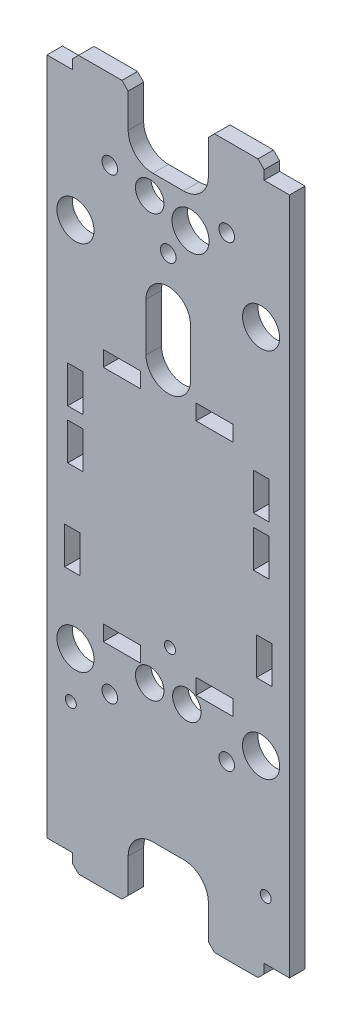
SolidWorks part; units mm, degrees
ref_plane "Front Plane" through (0, 0, 0) normal (0, 0, 1) x (1, 0, 0)
ref_plane "Top Plane" through (0, 0, 0) normal (0, 1, 0) x (1, 0, 0)
ref_plane "Right Plane" through (0, 0, 0) normal (1, 0, 0) x (0, 0, -1)
sketch "Sketch1" plane through (0, 0, 0) normal (0, 0, 1) x (1, 0, 0)
  line L1 (-24.892, 72.771) -> (24.892, 72.771)
  line L2 (-24.892, 72.771) -> (-24.892, -72.771)
  line L3 (-24.892, -72.771) -> (24.892, -72.771)
  line L4 (24.892, 72.771) -> (24.892, -72.771)
  line L5 (-24.892, 72.771) -> (24.892, -72.771) construction
  line L6 (-24.892, -72.771) -> (24.892, 72.771) construction
  point P0 (0, 0)
  dimension "D1" = 49.784
  dimension "D2" = 145.542
extrude "Boss-Extrude1" add sketch "Sketch1" along normal blind 3.175
sketch "Sketch2" plane through (0, 0, 0) normal (0, 0, -1) x (-1, 0, 0)
  line L0 (-24.892, 72.771) -> (24.892, 72.771) construction
  line L1 (-8.2296, 75.946) -> (8.2296, 75.946)
  line L2 (-8.2296, 75.946) -> (-8.2296, 69.596)
  line L3 (-8.2296, 69.596) -> (8.2296, 69.596)
  line L4 (8.2296, 75.946) -> (8.2296, 69.596)
  line L5 (-8.2296, 75.946) -> (8.2296, 69.596) construction
  line L6 (-8.2296, 69.596) -> (8.2296, 75.946) construction
  line L7 (0, 72.771) -> (0, -72.771) construction
  line L8 (-30.099, 75.946) -> (-19.685, 75.946)
  line L9 (-30.099, 75.946) -> (-30.099, 69.596)
  line L10 (-30.099, 69.596) -> (-19.685, 69.596)
  line L11 (-19.685, 75.946) -> (-19.685, 69.596)
  line L12 (-30.099, 75.946) -> (-19.685, 69.596) construction
  line L13 (-30.099, 69.596) -> (-19.685, 75.946) construction
  line L14 (24.892, -72.771) -> (-24.892, -72.771) construction
  line L15 (-24.892, 0) -> (24.892, 0) construction
  line L16 (-24.892, -72.771) -> (-24.892, 72.771) construction
  line L17 (24.892, 72.771) -> (24.892, -72.771) construction
  line L18 (30.099, 69.596) -> (19.685, 75.946) construction
  line L19 (30.099, 75.946) -> (19.685, 69.596) construction
  line L20 (19.685, 75.946) -> (19.685, 69.596)
  line L21 (30.099, 69.596) -> (19.685, 69.596)
  line L22 (30.099, 75.946) -> (30.099, 69.596)
  line L23 (30.099, 75.946) -> (19.685, 75.946)
  line L24 (30.099, -75.946) -> (19.685, -69.596) construction
  line L25 (30.099, -69.596) -> (19.685, -75.946) construction
  line L26 (-30.099, -69.596) -> (-19.685, -75.946) construction
  line L27 (-30.099, -75.946) -> (-19.685, -69.596) construction
  line L28 (-8.2296, -69.596) -> (8.2296, -75.946) construction
  line L29 (-8.2296, -75.946) -> (8.2296, -69.596) construction
  line L30 (30.099, -75.946) -> (19.685, -75.946)
  line L31 (30.099, -75.946) -> (30.099, -69.596)
  line L32 (30.099, -69.596) -> (19.685, -69.596)
  line L33 (19.685, -75.946) -> (19.685, -69.596)
  line L34 (-19.685, -75.946) -> (-19.685, -69.596)
  line L35 (-30.099, -69.596) -> (-19.685, -69.596)
  line L36 (-30.099, -75.946) -> (-30.099, -69.596)
  line L37 (-30.099, -75.946) -> (-19.685, -75.946)
  line L38 (8.2296, -75.946) -> (8.2296, -69.596)
  line L39 (-8.2296, -69.596) -> (8.2296, -69.596)
  line L40 (-8.2296, -75.946) -> (-8.2296, -69.596)
  line L41 (-8.2296, -75.946) -> (8.2296, -75.946)
  point P0 (0, 72.771)
  point P7 (-24.892, 72.771)
  point P27 (24.892, 72.771)
  point P40 (24.892, -72.771)
  point P41 (-24.892, -72.771)
  point P42 (0, -72.771)
extrude "Cut-Extrude1" cut sketch "Sketch2" against normal through all
sketch "Sketch3" plane through (0, 0, 0) normal (0, 0, -1) x (-1, 0, 0)
  line L0 (0, 69.596) -> (0, -69.596) construction
  line L1 (-8.2296, 69.596) -> (8.2296, 69.596) construction
  line L2 (8.2296, -69.596) -> (-8.2296, -69.596) construction
  line L3 (-24.892, 0) -> (24.892, 0) construction
  line L4 (-24.892, -69.596) -> (-24.892, 69.596) construction
  line L5 (24.892, 69.596) -> (24.892, -69.596) construction
  line L6 (-8.2296, -59.436) -> (8.2296, -79.756) construction
  line L7 (-8.2296, 79.756) -> (8.2296, 79.756)
  line L8 (-8.2296, 79.756) -> (-8.2296, 64.516)
  line L9 (-3.1496, 59.436) -> (3.1496, 59.436)
  line L10 (8.2296, 79.756) -> (8.2296, 64.516)
  line L11 (-8.2296, 79.756) -> (8.2296, 59.436) construction
  line L12 (-8.2296, 59.436) -> (8.2296, 79.756) construction
  line L13 (-8.2296, -79.756) -> (8.2296, -59.436) construction
  line L14 (8.2296, -79.756) -> (8.2296, -64.516)
  line L15 (-3.1496, -59.436) -> (3.1496, -59.436)
  line L16 (-8.2296, -79.756) -> (-8.2296, -64.516)
  line L17 (-8.2296, -79.756) -> (8.2296, -79.756)
  arc A0 (-8.2296, 64.516) -> (-3.1496, 59.436) centre (-3.1496, 64.516) ccw
  arc A1 (3.1496, 59.436) -> (8.2296, 64.516) centre (3.1496, 64.516) ccw
  arc A2 (3.1496, -59.436) -> (8.2296, -64.516) centre (3.1496, -64.516) cw
  arc A3 (-8.2296, -64.516) -> (-3.1496, -59.436) centre (-3.1496, -64.516) cw
  dimension "D3" = 5.08
  dimension "D4" = 5.08
  dimension "D1" = 20.32
  dimension "D2" = 16.4592
extrude "Cut-Extrude2" cut sketch "Sketch3" against normal through all
hole_wizard "M3 Clearance Hole1" positions "Sketch6" profile "Sketch5" hole size "M3" standard "ANSI Metric"
sketch "Sketch6" plane through (0, 0, 3.175) normal (0, 0, 1) x (1, 0, 0)
  line L0 (0, 59.436) -> (0, -59.436) construction
  line L1 (3.1496, 59.436) -> (-3.1496, 59.436) construction
  line L2 (-3.1496, -59.436) -> (3.1496, -59.436) construction
  line L4 (-24.892, 59.436) -> (24.892, 59.436) construction
  line L5 (-24.892, 69.596) -> (-24.892, -69.596) construction
  line L6 (24.892, -69.596) -> (24.892, 69.596) construction
  point P17 (-12, 56.436)
  point P19 (12, 56.436)
  point P21 (12, -37.564)
  point P23 (-12, -37.564)
  point P26 (0, 46.736)
  dimension "D1" = 3
  dimension "D2" = 3
  dimension "D3" = 12
  dimension "D4" = 12
  dimension "D5" = 94
  dimension "D6" = 94
  dimension "D7" = 12
  dimension "D8" = 12
  dimension "D9" = 12.7
sketch "Sketch5" plane through (0, 46.736, 3.175) normal (1, 0, 0) x (0, -1, 0)
  line L0 (0, 0) -> (0, 3.175)
  line L1 (0, 3.175) -> (1.6, 3.175)
  line L2 (1.6, 3.175) -> (1.6, 0)
  line L5 (1.6, 0) -> (0, 0)
  line L11 (0, -6.35) -> (0, 107.95) construction
  dimension "Thru Hole Dia." = 3.2
  dimension "Thru Hole Depth" = 3.175
hole_wizard "Tap Drill for #4-40 Tap1" positions "Sketch15" profile "Sketch16" hole size "#4-40" standard "ANSI Inch"
sketch "Sketch15" plane through (0, 0, 3.175) normal (0, 0, 1) x (1, 0, 0)
  line L1 (0, 0) -> (0.7916, -52.05) construction
  circle A0 centre (0, 46.736) radius 1.6 construction
  point P8 (0.3515, -23.114)
  dimension "D1" = 69.85
sketch "Sketch16" plane through (0.3515, -23.114, 3.175) normal (1, 0, 0) x (0, -1, 0)
  line L0 (0, 0) -> (0, 3.175)
  line L1 (0, 3.175) -> (1.1303, 3.175)
  line L2 (1.1303, 3.175) -> (1.1303, 0)
  line L5 (1.1303, 0) -> (0, 0)
  line L11 (0, -6.35) -> (0, 107.95) construction
  dimension "Thru Hole Dia." = 2.2606
  dimension "Thru Hole Depth" = 3.175
hole_wizard "#2 Clearance Hole1" positions "Sketch7" profile "Sketch8" hole size "#2" standard "ANSI Inch"
sketch "Sketch7" plane through (0, 0, 3.175) normal (0, 0, 1) x (1, 0, 0)
  line L0 (-24.892, -59.436) -> (24.892, -59.436) construction
  line L1 (-24.892, 69.596) -> (-24.892, -69.596) construction
  line L2 (24.892, -69.596) -> (24.892, 69.596) construction
  line L4 (0, -59.436) -> (0, 59.436) construction
  line L5 (3.1496, 59.436) -> (-3.1496, 59.436) construction
  point P15 (-20.005, -42.916)
  point P17 (20.005, -57.526)
sketch "Sketch8" plane through (20.005, -57.526, 3.175) normal (1, 0, 0) x (0, -1, 0)
  line L0 (0, 0) -> (0, 3.175)
  line L1 (0, 3.175) -> (1.1303, 3.175)
  line L2 (1.1303, 3.175) -> (1.1303, 0)
  line L5 (1.1303, 0) -> (0, 0)
  line L11 (0, -6.35) -> (0, 107.95) construction
  dimension "Thru Hole Dia." = 2.2606
  dimension "Thru Hole Depth" = 3.175
sketch "Sketch9" plane through (0, 0, 3.175) normal (0, 0, 1) x (1, 0, 0)
  line L0 (0, 59.436) -> (0, -59.436) construction
  line L1 (3.1496, 59.436) -> (-3.1496, 59.436) construction
  line L2 (-3.1496, -59.436) -> (3.1496, -59.436) construction
  line L3 (-24.892, 8.0853) -> (24.892, 8.0853) construction
  line L4 (-24.892, 69.596) -> (-24.892, -69.596) construction
  line L5 (24.892, -69.596) -> (24.892, 69.596) construction
  line L6 (-24.892, 21.4324) -> (24.892, 21.4324) construction
  line L7 (-20.6375, 16.9753) -> (-17.4625, 16.9753)
  line L8 (-20.6375, 16.9753) -> (-20.6375, 9.3553)
  line L9 (-20.6375, 9.3553) -> (-17.4625, 9.3553)
  line L10 (-17.4625, 16.9753) -> (-17.4625, 9.3553)
  line L11 (-20.6375, 16.9753) -> (-17.4625, 9.3553) construction
  line L12 (-20.6375, 9.3553) -> (-17.4625, 16.9753) construction
  line L18 (-13.335, 23.0199) -> (-5.715, 23.0199)
  line L19 (-13.335, 23.0199) -> (-13.335, 19.8449)
  line L20 (20.6375, 9.3553) -> (17.4625, 16.9753) construction
  line L21 (20.6375, 16.9753) -> (17.4625, 9.3553) construction
  line L26 (17.4625, 16.9753) -> (17.4625, 9.3553)
  line L27 (20.6375, 9.3553) -> (17.4625, 9.3553)
  line L28 (20.6375, 16.9753) -> (20.6375, 9.3553)
  line L29 (20.6375, 16.9753) -> (17.4625, 16.9753)
  line L30 (20.6375, -0.8047) -> (17.4625, 6.8153) construction
  line L31 (20.6375, 6.8153) -> (17.4625, -0.8047) construction
  line L32 (-13.335, 19.8449) -> (-5.715, 19.8449)
  line L33 (-5.715, 23.0199) -> (-5.715, 19.8449)
  line L34 (-13.335, 23.0199) -> (-5.715, 19.8449) construction
  line L35 (-20.6375, 6.8153) -> (-17.4625, -0.8047) construction
  line L36 (-20.6375, -0.8047) -> (-17.4625, 6.8153) construction
  line L37 (-13.335, 19.8449) -> (-5.715, 23.0199) construction
  line L38 (0, -43.2654) -> (0, 75.6066) construction
  line L39 (20.6375, -0.8047) -> (17.4625, -0.8047)
  line L40 (20.6375, -0.8047) -> (20.6375, 6.8153)
  line L41 (20.6375, 6.8153) -> (17.4625, 6.8153)
  line L42 (17.4625, -0.8047) -> (17.4625, 6.8153)
  line L51 (-17.4625, -0.8047) -> (-17.4625, 6.8153)
  line L52 (-20.6375, 6.8153) -> (-17.4625, 6.8153)
  line L53 (-20.6375, -0.8047) -> (-20.6375, 6.8153)
  line L54 (-20.6375, -0.8047) -> (-17.4625, -0.8047)
  line L55 (5.715, 23.0199) -> (13.335, 23.0199)
  line L56 (5.715, 23.0199) -> (5.715, 19.8449)
  line L57 (5.715, 19.8449) -> (13.335, 19.8449)
  line L58 (13.335, 23.0199) -> (13.335, 19.8449)
  line L59 (5.715, 23.0199) -> (13.335, 19.8449) construction
  line L60 (5.715, 19.8449) -> (13.335, 23.0199) construction
  point P12 (-19.05, 13.1653)
  point P17 (9.525, 21.4324)
  point P18 (-9.525, 21.4324)
  point P31 (19.05, 13.1653)
  point P50 (19.05, 3.0053)
  point P53 (-19.05, 3.0053)
extrude "Cut-Extrude3" cut sketch "Sketch9" against normal through all
sketch "Sketch10" plane through (0, 0, 3.175) normal (0, 0, 1) x (1, 0, 0)
  line L0 (0, 59.436) -> (0, -9.1192) construction
  line L1 (3.1496, 59.436) -> (-3.1496, 59.436) construction
  line L2 (0, 36.322) -> (0, 26.416) construction
  line L3 (4.572, 36.322) -> (4.572, 26.416)
  line L4 (-4.572, 36.322) -> (-4.572, 26.416)
  arc A0 (4.572, 36.322) -> (-4.572, 36.322) centre (0, 36.322) ccw
  arc A1 (-4.572, 26.416) -> (4.572, 26.416) centre (0, 26.416) ccw
  circle A2 centre (0, 46.736) radius 1.6 construction
  point P7 (0, 31.369)
extrude "Cut-Extrude4" cut sketch "Sketch10" against normal through all
sketch "Sketch11" plane through (0, 0, 3.175) normal (0, 0, 1) x (1, 0, 0)
  line L0 (0, 59.436) -> (0, -58.8932) construction
  line L1 (3.1496, 59.436) -> (-3.1496, 59.436) construction
  line L3 (24.892, -69.596) -> (24.892, 69.596) construction
  line L4 (24.892, 46.736) -> (-24.892, 46.736) construction
  line L5 (-24.892, 69.596) -> (-24.892, -69.596) construction
  line L7 (24.892, -23.114) -> (-24.892, -23.114) construction
  circle A0 centre (4.572, 53.086) radius 3.81
  circle A1 centre (-3.81, 55.118) radius 2.921
  circle A2 centre (3.81, -31.496) radius 2.921
  circle A3 centre (-3.81, -31.496) radius 2.921
  dimension "D1" = 5.842
  dimension "D2" = 5.842
  dimension "D7" = 7.62
  dimension "D8" = 5.842
  dimension "D3" = 8.382
  dimension "D4" = 8.382
  dimension "D5" = 3.81
  dimension "D6" = 3.81
  dimension "D9" = 8.382
  dimension "D10" = 3.81
  dimension "D11" = 6.35
  dimension "D12" = 4.572
extrude "Cut-Extrude5" cut sketch "Sketch11" against normal through all
sketch "Sketch12" plane through (0, 0, 3.175) normal (0, 0, 1) x (1, 0, 0)
  line L0 (0, 59.436) -> (0, -59.0729) construction
  line L1 (3.1496, 59.436) -> (-3.1496, 59.436) construction
  line L2 (-24.892, 0) -> (24.892, 0) construction
  line L3 (-24.892, 69.596) -> (-24.892, -69.596) construction
  line L4 (24.892, -69.596) -> (24.892, 69.596) construction
  circle A0 centre (19.05, 43.18) radius 3.81
  circle A1 centre (-19.05, 43.18) radius 3.81
  circle A2 centre (19.05, -33.02) radius 3.81
  circle A3 centre (-19.05, -33.02) radius 3.81
  dimension "D1" = 7.62
  dimension "D2" = 7.62
  dimension "D3" = 7.62
  dimension "D4" = 7.62
  dimension "D5" = 19.05
  dimension "D6" = 19.05
  dimension "D7" = 19.05
  dimension "D8" = 19.05
  dimension "D9" = 43.18
  dimension "D10" = 43.18
  dimension "D11" = 33.02
  dimension "D12" = 33.02
extrude "Cut-Extrude6" cut sketch "Sketch12" against normal through all
sketch "Sketch13" plane through (0, 0, 3.175) normal (0, 0, 1) x (1, 0, 0)
  line L0 (0, 59.436) -> (0, -59.436) construction
  line L1 (3.1496, 59.436) -> (-3.1496, 59.436) construction
  line L2 (-3.1496, -59.436) -> (3.1496, -59.436) construction
  line L3 (-24.892, -15.7856) -> (24.892, -15.7856) construction
  line L4 (-24.892, 69.596) -> (-24.892, -69.596) construction
  line L5 (24.892, -69.596) -> (24.892, 69.596) construction
  line L6 (24.892, -27.336) -> (-24.892, -27.336) construction
  line L7 (-21.2725, -11.9756) -> (-18.0975, -11.9756)
  line L8 (-21.2725, -11.9756) -> (-21.2725, -19.5956)
  line L9 (-21.2725, -19.5956) -> (-18.0975, -19.5956)
  line L10 (-18.0975, -11.9756) -> (-18.0975, -19.5956)
  line L11 (-21.2725, -11.9756) -> (-18.0975, -19.5956) construction
  line L12 (-21.2725, -19.5956) -> (-18.0975, -11.9756) construction
  line L18 (5.715, -25.7485) -> (13.335, -25.7485)
  line L19 (5.715, -25.7485) -> (5.715, -28.9235)
  line L20 (21.2725, -19.5956) -> (18.0975, -11.9756) construction
  line L21 (21.2725, -11.9756) -> (18.0975, -19.5956) construction
  line L26 (18.0975, -11.9756) -> (18.0975, -19.5956)
  line L27 (21.2725, -19.5956) -> (18.0975, -19.5956)
  line L28 (21.2725, -11.9756) -> (21.2725, -19.5956)
  line L29 (21.2725, -11.9756) -> (18.0975, -11.9756)
  line L30 (5.715, -28.9235) -> (13.335, -28.9235)
  line L31 (13.335, -25.7485) -> (13.335, -28.9235)
  line L32 (5.715, -25.7485) -> (13.335, -28.9235) construction
  line L33 (5.715, -28.9235) -> (13.335, -25.7485) construction
  line L34 (-13.335, -25.7485) -> (-5.715, -25.7485)
  line L35 (-13.335, -25.7485) -> (-13.335, -28.9235)
  line L36 (-13.335, -28.9235) -> (-5.715, -28.9235)
  line L37 (-5.715, -25.7485) -> (-5.715, -28.9235)
  line L38 (-13.335, -25.7485) -> (-5.715, -28.9235) construction
  line L39 (-13.335, -28.9235) -> (-5.715, -25.7485) construction
  point P12 (-19.685, -15.7856)
  point P19 (9.525, -27.336)
  point P24 (-9.525, -27.336)
  point P31 (19.685, -15.7856)
extrude "Cut-Extrude7" cut sketch "Sketch13" against normal through all
chamfer "Chamfer1" distance 1.27 8 edges at (-19.685, 72.771, 1.5875) (8.2296, 72.771, 1.5875) (19.685, 72.771, 1.5875) (-19.685, -72.771, 1.5875) (-8.2296, -72.771, 1.5875) (19.685, -72.771, 1.5875) (8.2296, -72.771, 1.5875) (-8.2296, 72.771, 1.5875)
sketch "Sketch17" plane through (0, 0, 3.175) normal (0, 0, 1) x (1, 0, 0)
  line L32 (-4.4704, 36.322) -> (-4.4704, 26.416)
  line L33 (4.4704, 26.416) -> (4.4704, 36.322)
  line L34 (-4.4704, 36.322) -> (-4.4704, 26.416)
  line L35 (4.4704, 26.416) -> (4.4704, 36.322)
  line L42 (-5.8166, 19.9465) -> (-5.8166, 22.9183)
  line L43 (-5.8166, 22.9183) -> (-13.2334, 22.9183)
  line L44 (-13.2334, 22.9183) -> (-13.2334, 19.9465)
  line L45 (-13.2334, 19.9465) -> (-5.8166, 19.9465)
  line L46 (-5.8166, 19.9465) -> (-5.8166, 22.9183)
  line L47 (-5.8166, 22.9183) -> (-13.2334, 22.9183)
  line L48 (-13.2334, 22.9183) -> (-13.2334, 19.9465)
  line L49 (-13.2334, 19.9465) -> (-5.8166, 19.9465)
  line L54 (13.2334, 19.9465) -> (13.2334, 22.9183)
  line L55 (5.8166, 19.9465) -> (13.2334, 19.9465)
  line L56 (-8.128, 64.516) -> (-8.128, 71.5431)
  line L57 (-8.128, 71.5431) -> (-9.4575, 72.8726)
  line L58 (-9.4575, 72.8726) -> (-18.4571, 72.8726)
  line L59 (-18.4571, 72.8726) -> (-19.7866, 71.5431)
  line L60 (-19.7866, 71.5431) -> (-19.7866, 69.6976)
  line L61 (-19.7866, 69.6976) -> (-24.9936, 69.6976)
  line L62 (-24.9936, 69.6976) -> (-24.9936, -69.6976)
  line L63 (-24.9936, -69.6976) -> (-19.7866, -69.6976)
  line L64 (-19.7866, -69.6976) -> (-19.7866, -71.5431)
  line L65 (-19.7866, -71.5431) -> (-18.4571, -72.8726)
  line L66 (-18.4571, -72.8726) -> (-9.4575, -72.8726)
  line L67 (-9.4575, -72.8726) -> (-8.128, -71.5431)
  line L68 (-8.128, -71.5431) -> (-8.128, -64.516)
  line L69 (-3.1496, -59.5376) -> (3.1496, -59.5376)
  line L70 (8.128, -64.516) -> (8.128, -71.5431)
  line L71 (8.128, -71.5431) -> (9.4575, -72.8726)
  line L72 (9.4575, -72.8726) -> (18.4571, -72.8726)
  line L73 (18.4571, -72.8726) -> (19.7866, -71.5431)
  line L74 (19.7866, -71.5431) -> (19.7866, -69.6976)
  line L75 (19.7866, -69.6976) -> (24.9936, -69.6976)
  line L76 (24.9936, -69.6976) -> (24.9936, 69.6976)
  line L77 (24.9936, 69.6976) -> (19.7866, 69.6976)
  line L78 (19.7866, 69.6976) -> (19.7866, 71.5431)
  line L79 (19.7866, 71.5431) -> (18.4571, 72.8726)
  line L80 (18.4571, 72.8726) -> (9.4575, 72.8726)
  line L81 (9.4575, 72.8726) -> (8.128, 71.5431)
  line L82 (8.128, 71.5431) -> (8.128, 64.516)
  line L83 (3.1496, 59.5376) -> (-3.1496, 59.5376)
  line L84 (-8.128, 64.516) -> (-8.128, 71.5431)
  line L85 (-8.128, 71.5431) -> (-9.4575, 72.8726)
  line L86 (-9.4575, 72.8726) -> (-18.4571, 72.8726)
  line L87 (-18.4571, 72.8726) -> (-19.7866, 71.5431)
  line L88 (-19.7866, 71.5431) -> (-19.7866, 69.6976)
  line L89 (-19.7866, 69.6976) -> (-24.9936, 69.6976)
  line L90 (-24.9936, 69.6976) -> (-24.9936, -69.6976)
  line L91 (-24.9936, -69.6976) -> (-19.7866, -69.6976)
  line L92 (-19.7866, -69.6976) -> (-19.7866, -71.5431)
  line L93 (-19.7866, -71.5431) -> (-18.4571, -72.8726)
  line L94 (-18.4571, -72.8726) -> (-9.4575, -72.8726)
  line L95 (-9.4575, -72.8726) -> (-8.128, -71.5431)
  line L96 (-8.128, -71.5431) -> (-8.128, -64.516)
  line L97 (-3.1496, -59.5376) -> (3.1496, -59.5376)
  line L98 (8.128, -64.516) -> (8.128, -71.5431)
  line L99 (8.128, -71.5431) -> (9.4575, -72.8726)
  line L100 (9.4575, -72.8726) -> (18.4571, -72.8726)
  line L101 (18.4571, -72.8726) -> (19.7866, -71.5431)
  line L102 (19.7866, -71.5431) -> (19.7866, -69.6976)
  line L103 (19.7866, -69.6976) -> (24.9936, -69.6976)
  line L104 (24.9936, -69.6976) -> (24.9936, 69.6976)
  line L105 (24.9936, 69.6976) -> (19.7866, 69.6976)
  line L106 (19.7866, 69.6976) -> (19.7866, 71.5431)
  line L107 (19.7866, 71.5431) -> (18.4571, 72.8726)
  line L108 (18.4571, 72.8726) -> (9.4575, 72.8726)
  line L109 (9.4575, 72.8726) -> (8.128, 71.5431)
  line L110 (8.128, 71.5431) -> (8.128, 64.516)
  line L111 (3.1496, 59.5376) -> (-3.1496, 59.5376)
  line L112 (5.8166, 22.9183) -> (5.8166, 19.9465)
  line L113 (13.2334, 22.9183) -> (5.8166, 22.9183)
  line L114 (13.2334, 19.9465) -> (13.2334, 22.9183)
  line L115 (5.8166, 19.9465) -> (13.2334, 19.9465)
  line L116 (5.8166, 22.9183) -> (5.8166, 19.9465)
  line L117 (13.2334, 22.9183) -> (5.8166, 22.9183)
  line L122 (-20.5359, 9.4569) -> (-17.5641, 9.4569)
  line L123 (-20.5359, 16.8737) -> (-20.5359, 9.4569)
  line L124 (-17.5641, 16.8737) -> (-20.5359, 16.8737)
  line L125 (-17.5641, 9.4569) -> (-17.5641, 16.8737)
  line L126 (-20.5359, 9.4569) -> (-17.5641, 9.4569)
  line L127 (-20.5359, 16.8737) -> (-20.5359, 9.4569)
  line L128 (-17.5641, 16.8737) -> (-20.5359, 16.8737)
  line L129 (-17.5641, 9.4569) -> (-17.5641, 16.8737)
  line L134 (-20.5359, -0.7031) -> (-17.5641, -0.7031)
  line L135 (-20.5359, 6.7137) -> (-20.5359, -0.7031)
  line L136 (-17.5641, 6.7137) -> (-20.5359, 6.7137)
  line L137 (-17.5641, -0.7031) -> (-17.5641, 6.7137)
  line L138 (-20.5359, -0.7031) -> (-17.5641, -0.7031)
  line L139 (-20.5359, 6.7137) -> (-20.5359, -0.7031)
  line L140 (-17.5641, 6.7137) -> (-20.5359, 6.7137)
  line L141 (-17.5641, -0.7031) -> (-17.5641, 6.7137)
  line L146 (17.5641, 9.4569) -> (20.5359, 9.4569)
  line L147 (17.5641, 16.8737) -> (17.5641, 9.4569)
  line L148 (20.5359, 16.8737) -> (17.5641, 16.8737)
  line L149 (20.5359, 9.4569) -> (20.5359, 16.8737)
  line L150 (17.5641, 9.4569) -> (20.5359, 9.4569)
  line L151 (17.5641, 16.8737) -> (17.5641, 9.4569)
  line L152 (20.5359, 16.8737) -> (17.5641, 16.8737)
  line L153 (20.5359, 9.4569) -> (20.5359, 16.8737)
  line L158 (17.5641, -0.7031) -> (20.5359, -0.7031)
  line L159 (17.5641, 6.7137) -> (17.5641, -0.7031)
  line L160 (20.5359, -0.7031) -> (20.5359, 6.7137)
  line L161 (20.5359, 6.7137) -> (17.5641, 6.7137)
  line L162 (17.5641, -0.7031) -> (20.5359, -0.7031)
  line L163 (17.5641, 6.7137) -> (17.5641, -0.7031)
  line L164 (20.5359, -0.7031) -> (20.5359, 6.7137)
  line L165 (20.5359, 6.7137) -> (17.5641, 6.7137)
  line L170 (-21.1709, -19.494) -> (-18.1991, -19.494)
  line L171 (-21.1709, -12.0772) -> (-21.1709, -19.494)
  line L172 (-18.1991, -12.0772) -> (-21.1709, -12.0772)
  line L173 (-18.1991, -19.494) -> (-18.1991, -12.0772)
  line L174 (-21.1709, -19.494) -> (-18.1991, -19.494)
  line L175 (-21.1709, -12.0772) -> (-21.1709, -19.494)
  line L176 (-18.1991, -12.0772) -> (-21.1709, -12.0772)
  line L177 (-18.1991, -19.494) -> (-18.1991, -12.0772)
  line L182 (-13.2334, -25.8501) -> (-13.2334, -28.8219)
  line L183 (-13.2334, -28.8219) -> (-5.8166, -28.8219)
  line L184 (-5.8166, -28.8219) -> (-5.8166, -25.8501)
  line L185 (-5.8166, -25.8501) -> (-13.2334, -25.8501)
  line L186 (-13.2334, -25.8501) -> (-13.2334, -28.8219)
  line L187 (-13.2334, -28.8219) -> (-5.8166, -28.8219)
  line L188 (-5.8166, -28.8219) -> (-5.8166, -25.8501)
  line L189 (-5.8166, -25.8501) -> (-13.2334, -25.8501)
  line L194 (5.8166, -28.8219) -> (13.2334, -28.8219)
  line L195 (13.2334, -28.8219) -> (13.2334, -25.8501)
  line L196 (5.8166, -25.8501) -> (5.8166, -28.8219)
  line L197 (13.2334, -25.8501) -> (5.8166, -25.8501)
  line L198 (5.8166, -28.8219) -> (13.2334, -28.8219)
  line L199 (13.2334, -28.8219) -> (13.2334, -25.8501)
  line L200 (5.8166, -25.8501) -> (5.8166, -28.8219)
  line L201 (13.2334, -25.8501) -> (5.8166, -25.8501)
  line L206 (18.1991, -19.494) -> (21.1709, -19.494)
  line L207 (21.1709, -19.494) -> (21.1709, -12.0772)
  line L208 (18.1991, -12.0772) -> (18.1991, -19.494)
  line L209 (21.1709, -12.0772) -> (18.1991, -12.0772)
  line L210 (18.1991, -19.494) -> (21.1709, -19.494)
  line L211 (21.1709, -19.494) -> (21.1709, -12.0772)
  line L212 (18.1991, -12.0772) -> (18.1991, -19.494)
  line L213 (21.1709, -12.0772) -> (18.1991, -12.0772)
  circle A6 centre (-12, 56.436) radius 1.4984
  circle A7 centre (-12, 56.436) radius 1.4984
  arc A8 (-3.1496, -59.5376) -> (-8.128, -64.516) centre (-3.1496, -64.516) ccw
  arc A9 (8.128, -64.516) -> (3.1496, -59.5376) centre (3.1496, -64.516) ccw
  arc A10 (3.1496, 59.5376) -> (8.128, 64.516) centre (3.1496, 64.516) ccw
  arc A11 (-8.128, 64.516) -> (-3.1496, 59.5376) centre (-3.1496, 64.516) ccw
  arc A12 (-3.1496, -59.5376) -> (-8.128, -64.516) centre (-3.1496, -64.516) ccw
  arc A13 (8.128, -64.516) -> (3.1496, -59.5376) centre (3.1496, -64.516) ccw
  arc A14 (3.1496, 59.5376) -> (8.128, 64.516) centre (3.1496, 64.516) ccw
  arc A15 (-8.128, 64.516) -> (-3.1496, 59.5376) centre (-3.1496, 64.516) ccw
  circle A17 centre (-3.81, 55.118) radius 2.8194
  circle A18 centre (-3.81, 55.118) radius 2.8194
  circle A20 centre (4.572, 53.086) radius 3.7084
  circle A21 centre (4.572, 53.086) radius 3.7084
  circle A23 centre (12, 56.436) radius 1.4984
  circle A24 centre (12, 56.436) radius 1.4984
  circle A26 centre (0, 46.736) radius 1.4984
  circle A27 centre (0, 46.736) radius 1.4984
  circle A29 centre (-19.05, 43.18) radius 3.7084
  circle A30 centre (-19.05, 43.18) radius 3.7084
  circle A32 centre (19.05, 43.18) radius 3.7084
  circle A33 centre (19.05, 43.18) radius 3.7084
  arc A37 (-4.4704, 26.416) -> (4.4704, 26.416) centre (0, 26.416) ccw
  arc A38 (4.4704, 36.322) -> (-4.4704, 36.322) centre (0, 36.322) ccw
  arc A39 (-4.4704, 26.416) -> (4.4704, 26.416) centre (0, 26.416) ccw
  arc A40 (4.4704, 36.322) -> (-4.4704, 36.322) centre (0, 36.322) ccw
  circle A41 centre (0.3515, -23.114) radius 1.0287
  circle A42 centre (0.3515, -23.114) radius 1.0287
  circle A44 centre (-3.81, -31.496) radius 2.8194
  circle A45 centre (-3.81, -31.496) radius 2.8194
  circle A47 centre (3.81, -31.496) radius 2.8194
  circle A48 centre (3.81, -31.496) radius 2.8194
  circle A50 centre (-19.05, -33.02) radius 3.7084
  circle A51 centre (-19.05, -33.02) radius 3.7084
  circle A53 centre (-12, -37.564) radius 1.4984
  circle A54 centre (-12, -37.564) radius 1.4984
  circle A56 centre (-20.005, -42.916) radius 1.0287
  circle A57 centre (-20.005, -42.916) radius 1.0287
  circle A59 centre (12, -37.564) radius 1.4984
  circle A60 centre (12, -37.564) radius 1.4984
  circle A62 centre (19.05, -33.02) radius 3.7084
  circle A63 centre (19.05, -33.02) radius 3.7084
  circle A65 centre (20.005, -57.526) radius 1.0287
  circle A66 centre (20.005, -57.526) radius 1.0287
equation "\"D3@Sketch2\"=.324+.451"
equation "\"D2@Sketch7\"=1.91mm+14.61mm"
equation "\"D2@Sketch10\"=.800-.410"
equation "\"t\" = .125in'plywood thickness"
equation "\"kerf\"= .004in'laser cutter kerf"
equation "\"D2@Sketch2\"=\"t\"*2"
equation "\"D4@Sketch2\"=\"t\"*2"
equation "\"D6@Sketch9\"=\"t\""
equation "\"D5@Sketch9\"=\"t\""
equation "\"D7@Sketch13\"=\"t\""
equation "\"D5@Sketch13\"=\"t\""
equation "\"D1@Sketch17\"=\"kerf\""
equation "\"D2@Sketch17\"=\"kerf\""
equation "\"D6@Sketch17\"=\"kerf\""
equation "\"D7@Sketch17\"=\"kerf\""
equation "\"D3@Sketch17\"=\"kerf\""
equation "\"D4@Sketch17\"=\"kerf\""
equation "\"D5@Sketch17\"=\"kerf\""
equation "\"D8@Sketch17\"=\"kerf\""
equation "\"D9@Sketch17\"=\"kerf\""
equation "\"D10@Sketch17\"=\"kerf\""
equation "\"D11@Sketch17\"=\"kerf\""
equation "\"D14@Sketch17\"=\"kerf\""
equation "\"D15@Sketch17\"=\"kerf\""
equation "\"D12@Sketch17\"=\"kerf\""
equation "\"D13@Sketch17\"=\"kerf\""
equation "\"D16@Sketch17\"=\"kerf\""
equation "\"D18@Sketch17\"=\"kerf\""
equation "\"D20@Sketch17\"=\"kerf\""
equation "\"D19@Sketch17\"=\"kerf\""
equation "\"D17@Sketch17\"=\"kerf\""
equation "\"D23@Sketch17\"=\"kerf\""
equation "\"D24@Sketch17\"=\"kerf\""
equation "\"D21@Sketch17\"=\"kerf\""
equation "\"D22@Sketch17\"=\"kerf\""
equation "\"D25@Sketch17\"=\"kerf\""
equation "\"D28@Sketch17\"=\"kerf\""
equation "\"D26@Sketch17\"=\"kerf\""
equation "\"D27@Sketch17\"=\"kerf\""
